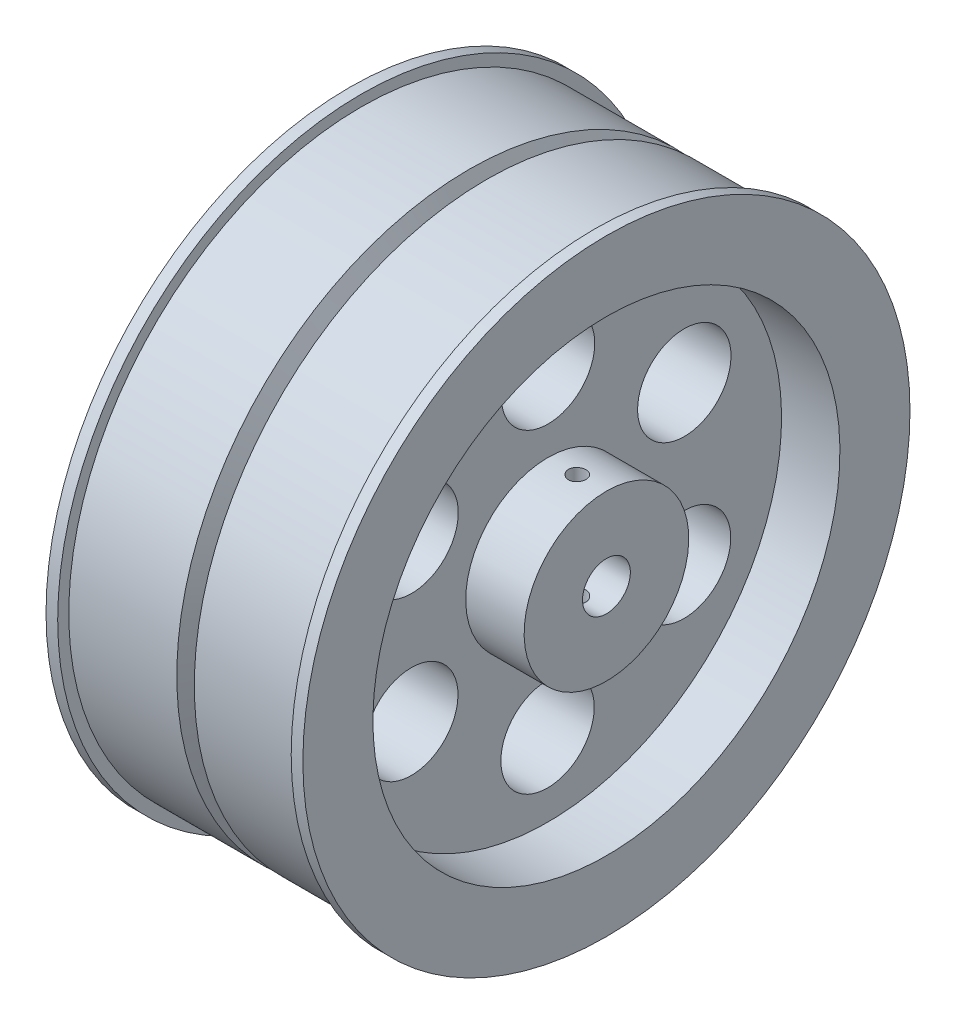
SolidWorks part; units mm, degrees
ref_plane "Front Plane" through (0, 0, 0) normal (0, 0, 1) x (1, 0, 0)
ref_plane "Top Plane" through (0, 0, 0) normal (0, 1, 0) x (1, 0, 0)
ref_plane "Right Plane" through (0, 0, 0) normal (1, 0, 0) x (0, 0, -1)
sketch "Sketch1" plane through (0, 0, 0) normal (0, 0, 1) x (1, 0, 0)
  line L0 (0, 0) -> (0, 10)
  line L1 (0, 10) -> (10, 10)
  line L2 (10, 10) -> (10, 35.9)
  line L3 (10, 35.9) -> (0, 35.9)
  line L4 (0, 35.9) -> (0, 45.9)
  line L5 (2, 46) -> (17, 46)
  line L11 (44, 0) -> (0, 0)
  line L12 (44, 0) -> (44, -4.1) construction
  line L13 (44, -4.1) -> (30.0755, -4.1) construction
  line L14 (44, 45.9) -> (44, 35.9)
  line L15 (27, 46) -> (23.5, 46) construction
  line L17 (44, 10) -> (34, 10)
  line L18 (34, 10) -> (34, 35.9)
  line L20 (27, 46) -> (42, 46)
  line L21 (34, 35.9) -> (44, 35.9)
  line L22 (44, 10) -> (44, 0)
  line L23 (17, 46) -> (20.5, 46) construction
  line L24 (22, 46) -> (22, 43) construction
  line L27 (0, 45.9) -> (0, 47.9)
  line L28 (0, 47.9) -> (2, 47.9)
  line L29 (2, 47.9) -> (2, 46)
  line L30 (42, 47.9) -> (42, 46)
  line L31 (44, 47.9) -> (42, 47.9)
  line L32 (44, 45.9) -> (44, 47.9)
  line L34 (20.5, 46) -> (22, 43)
  line L35 (23.5, 46) -> (22, 43)
  line L36 (17, 46) -> (20.5, 46)
  line L37 (23.5, 46) -> (27, 46)
  line L38 (20.5, 46) -> (17, 46) construction
  line L39 (20.5, 46) -> (23.5, 46) construction
  point P25 (22, 46)
  point P28 (22, 46)
  dimension "D1" = 4.1
  dimension "D2" = 50
  dimension "D3" = 44
  dimension "D4" = 18.5
  dimension "D5" = 10
  dimension "D6" = 10
  dimension "D7" = 10
  dimension "D8" = 2
  dimension "D9" = 2
  dimension "D10" = 18.5
  dimension "D11" = 3
revolve "Revolve1" add sketch "Sketch1" angle 360 about L13
ref_plane "centre back " through (22, 0, 0) normal (1, 0, 0) x (0, 0, -1)
sketch "Sketch2" plane through (34, 0, 0) normal (1, 0, 0) x (0, 0, -1)
  line L0 (0, 10) -> (0, 35.9) construction
  circle A0 centre (0, -4.1) radius 14.1 construction
  circle A1 centre (0, -4.1) radius 14.1 construction
  circle A2 centre (0, -4.1) radius 40 construction
  circle A3 centre (0, 22.95) radius 8
  circle A4 centre (23.3394, 9.425) radius 8
  circle A5 centre (23.2961, -17.55) radius 8
  circle A6 centre (-0.0866, -31) radius 8
  circle A7 centre (-23.426, -17.475) radius 8
  circle A8 centre (-23.3827, 9.5) radius 8
  point P24 (-0.0433, -4.025)
  dimension "D1" = 16
  dimension "D2" = 6
extrude "Cut-Extrude1" cut sketch "Sketch2" against normal through all
sketch "Sketch4" plane through (0, 0, 0) normal (0, 1, 0) x (1, 0, 0)
  line L0 (34.0339, 0) -> (44, 0) construction
  line L1 (44, -14.1) -> (44, 14.1) construction
  circle A0 centre (39.0169, 0) radius 1.5
  dimension "D1" = 3
extrude "Cut-Extrude2" cut sketch "Sketch4" against normal blind 19 and the other way blind 10
